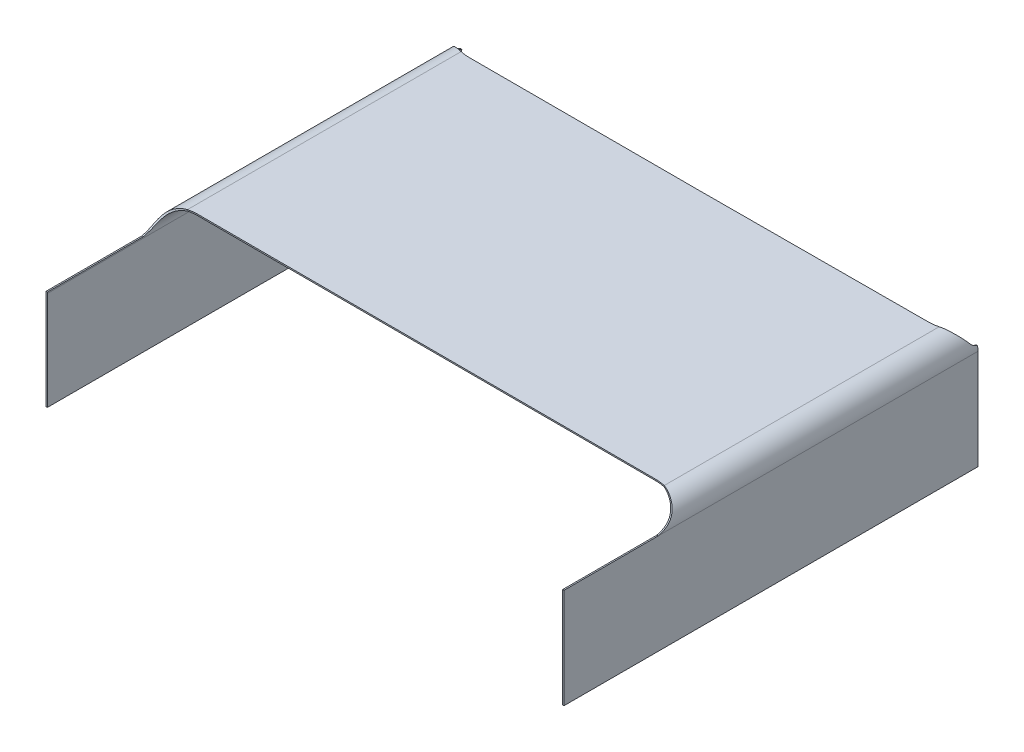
SolidWorks part; units mm, degrees
ref_plane "Front Plane" through (0, 0, 0) normal (0, 0, 1) x (1, 0, 0)
ref_plane "Top Plane" through (0, 0, 0) normal (0, 1, 0) x (1, 0, 0)
ref_plane "Right Plane" through (0, 0, 0) normal (1, 0, 0) x (0, 0, -1)
sketch "Sketch1" plane through (0, 0, 0) normal (0, 0, 1) x (1, 0, 0)
  line L0 (-5.5465, 0) -> (292.9035, 0)
  line L1 (305.6035, -12.7) -> (305.6035, -75.2094)
  line L2 (305.6035, -75.2094) -> (304.7907, -75.2094)
  line L3 (304.7907, -75.2094) -> (304.7907, -13.5128)
  line L4 (292.0907, -0.8128) -> (-4.7337, -0.8128)
  line L5 (-17.4337, -13.5128) -> (-17.4337, -75.2094)
  line L6 (-18.2465, -12.7) -> (-18.2465, -75.2094)
  line L7 (-18.2465, -75.2094) -> (-17.4337, -75.2094)
  arc A0 (-18.2465, -12.7) -> (-5.5465, 0) centre (-5.5465, -12.7) cw
  arc A1 (-4.7337, -0.8128) -> (-17.4337, -13.5128) centre (-4.7337, -13.5128) ccw
  arc A2 (305.6035, -12.7) -> (292.9035, 0) centre (292.9035, -12.7) ccw
  arc A3 (304.7907, -13.5128) -> (292.0907, -0.8128) centre (292.0907, -13.5128) ccw
  point P11 (-18.2465, 0)
  point P16 (305.6035, 0)
  dimension "D7" = 12.7
  dimension "D1" = 0.8128
  dimension "D2" = 0.8128
  dimension "D3" = 0.8128
  dimension "D4" = 323.85
  dimension "D5" = 75.2094
  dimension "D6" = 75.2094
extrude "Boss-Extrude1" add sketch "Sketch1" along normal blind 258.9022
sketch "Sketch2" plane through (0, 0, 0) normal (0, 1, 0) x (1, 0, 0)
  line L0 (292.9035, 0) -> (-5.5465, 0) construction
  line L1 (23.6635, -12.7) -> (263.6935, -12.7) construction
  line L2 (23.6635, -12.7) -> (23.6635, -182.7022) construction
  line L3 (23.6635, -182.7022) -> (263.6935, -182.7022) construction
  line L4 (263.6935, -12.7) -> (263.6935, -182.7022) construction
  line L5 (23.6635, -12.7) -> (263.6935, -182.7022) construction
  line L6 (23.6635, -182.7022) -> (263.6935, -12.7) construction
  line L7 (0.4225, -182.7022) -> (286.9345, -182.7022)
  line L8 (312.3345, -208.1022) -> (312.3345, -282.9693)
  line L10 (312.3345, -282.9693) -> (-24.9775, -282.9693)
  line L11 (-24.9775, -282.9693) -> (-24.9775, -208.1022)
  line L12 (-5.5465, -258.9022) -> (-5.5465, 0) construction
  line L13 (292.9035, -258.9022) -> (292.9035, 0) construction
  line L14 (0.4225, -12.7) -> (286.9345, -12.7)
  line L15 (312.3345, 12.7) -> (312.3345, 23.7628)
  line L16 (312.3345, 23.7628) -> (-24.9775, 23.7628)
  line L17 (-24.9775, 23.7628) -> (-24.9775, 12.7)
  arc A0 (312.3345, -208.1022) -> (286.9345, -182.7022) centre (286.9345, -208.1022) ccw
  arc A1 (0.4225, -182.7022) -> (-24.9775, -208.1022) centre (0.4225, -208.1022) ccw
  arc A2 (0.4225, -12.7) -> (-24.9775, 12.7) centre (0.4225, 12.7) cw
  arc A3 (312.3345, 12.7) -> (286.9345, -12.7) centre (286.9345, 12.7) cw
  point P0 (143.6785, -97.7011)
  point P7 (143.6785, 0)
  dimension "D7" = 25.4
  dimension "D10" = 25.4
  dimension "D1" = 12.7
  dimension "D2" = 170.0022
  dimension "D3" = 240.03
  dimension "D4" = 0
  dimension "D5" = 19.431
  dimension "D6" = 19.431
  dimension "D8" = 19.431
  dimension "D9" = 19.431
wrap "Wrap1" sketch "Sketch2" wrap type deboss source sketch "Sketch2" thickness 2.54 parameters "D1"=2.54
